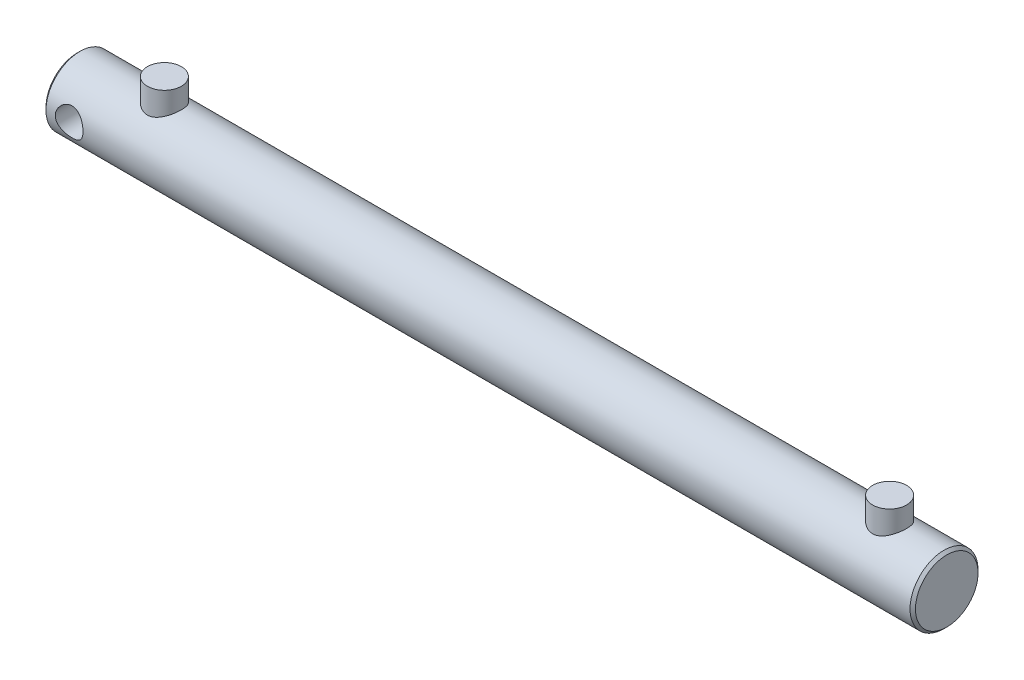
SolidWorks part; units mm, degrees
ref_plane "Plan de face" through (0, 0, 0) normal (0, 0, 1) x (1, 0, 0)
ref_plane "Plan de dessus" through (0, 0, 0) normal (0, 1, 0) x (1, 0, 0)
ref_plane "Plan de droite" through (0, 0, 0) normal (1, 0, 0) x (0, 0, -1)
sketch "Esquisse1" plane through (0, 0, 0) normal (0, 0, 1) x (1, 0, 0)
  line L0 (-319.5, 0) -> (319.5, 0) construction
  line L1 (-319.5, 0) -> (-319.5, 25)
  line L2 (-319.5, 25) -> (319.5, 25)
  line L3 (319.5, 25) -> (319.5, 0)
  line L6 (-319.5, 0) -> (319.5, 0)
  dimension "D1" = 50
  dimension "D3" = 639
revolve "Révolution1" add sketch "Esquisse1" angle 360 about L0
chamfer "Chanfrein1" distance 2 angle 45 2 edges at (319.5, 0, 25) (-319.5, 0, 25)
sketch "Esquisse3" plane through (0, 0, 0) normal (0, 0, 1) x (1, 0, 0)
  line L0 (-319.5, 23) -> (-319.5, -23) construction
  circle A0 centre (-300.5, 0) radius 10.2
  dimension "D1" = 20.4
  dimension "D2" = 19
extrude "Enlèv. mat.-Extru.1" cut sketch "Esquisse3" against normal through all and the other way through all
sketch "Esquisse5" plane through (0, 0, 0) normal (0, 1, 0) x (1, 0, 0)
  line L0 (-319.5, 23) -> (-319.5, -23) construction
  line L1 (319.5, -23) -> (319.5, 23) construction
  circle A0 centre (-255.5, 0) radius 12.5
  circle A1 centre (277.5, 0) radius 12.5
  dimension "D1" = 25
  dimension "D2" = 64
  dimension "D3" = 42
extrude "Extrusion2" add sketch "Esquisse5" along normal blind 40
